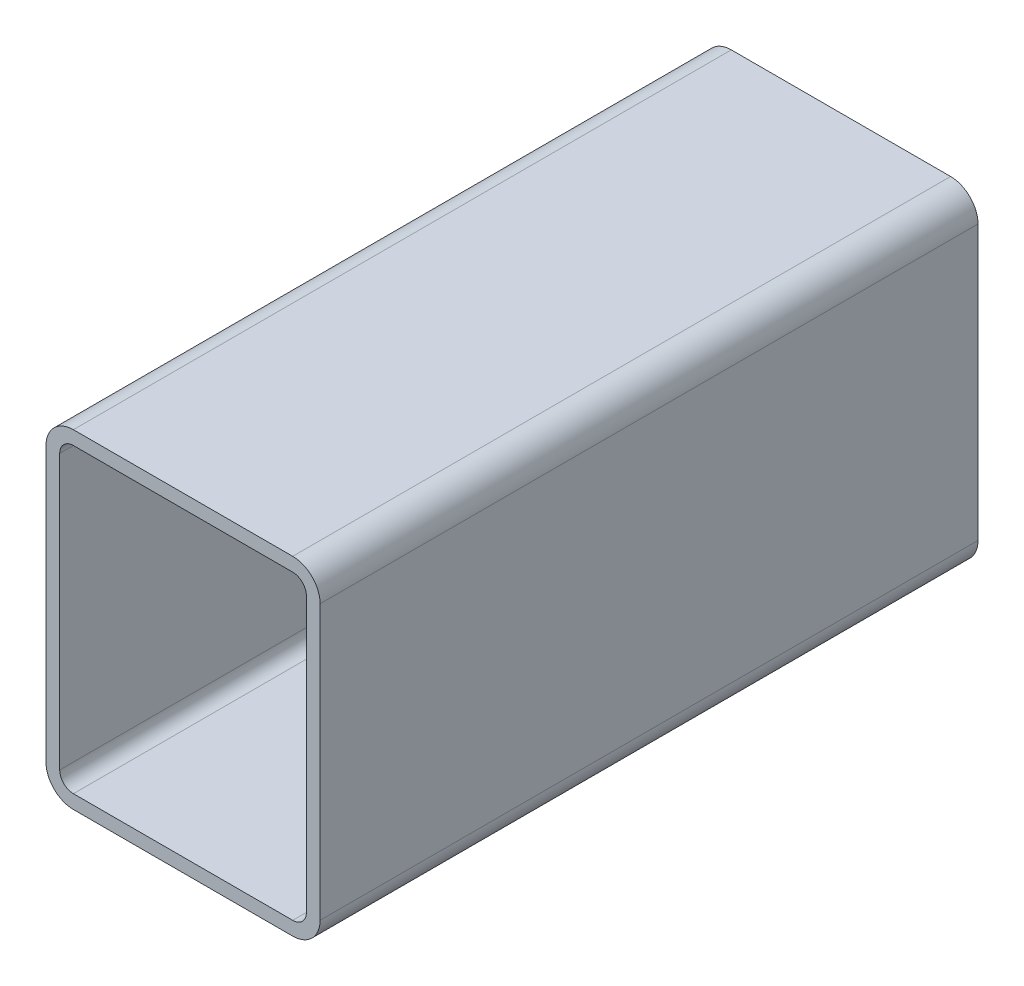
SolidWorks part; units mm, degrees
ref_plane "Front Plane" through (0, 0, 0) normal (0, 0, 1) x (1, 0, 0)
ref_plane "Top Plane" through (0, 0, 0) normal (0, 1, 0) x (1, 0, 0)
ref_plane "Right Plane" through (0, 0, 0) normal (1, 0, 0) x (0, 0, -1)
sketch "Sketch1" plane through (0, 0, 0) normal (0, 0, 1) x (1, 0, 0)
sketch_block_instance "HSS6x5x0.250-1"
sketch_block "HSS6x5x0.250"
extrude "Boss-Extrude1" add sketch "Sketch1" along normal blind 304.8
